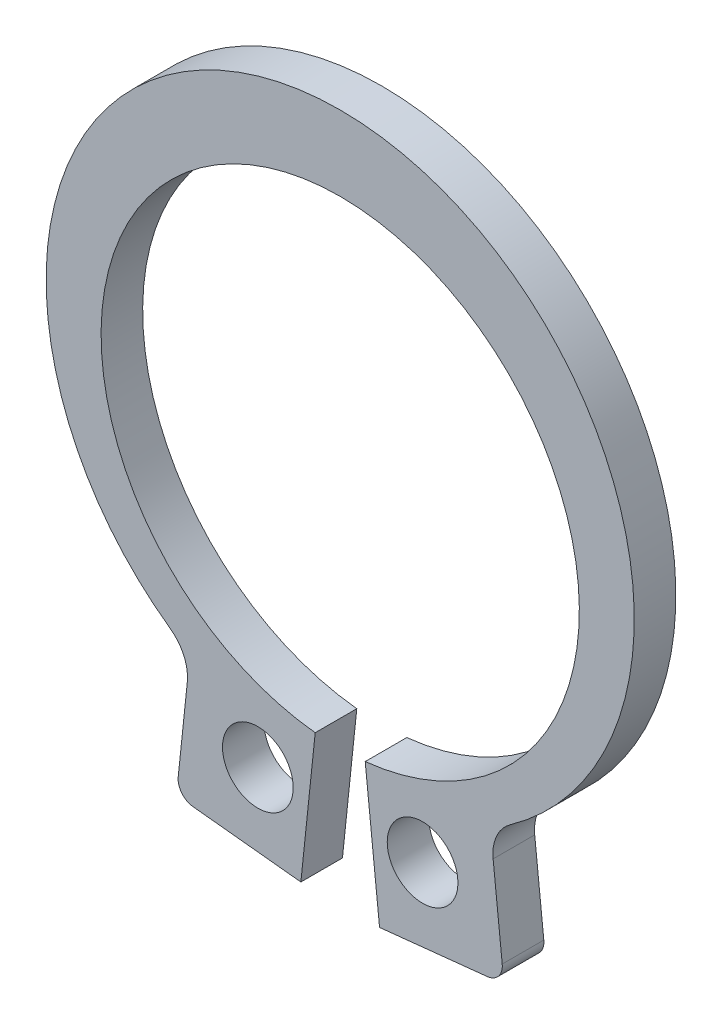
SolidWorks part; units mm, degrees
ref_plane "Face" through (0, 0, 0) normal (0, 0, 1) x (1, 0, 0)
ref_plane "Dessus" through (0, 0, 0) normal (0, 1, 0) x (1, 0, 0)
ref_plane "Droite" through (0, 0, 0) normal (1, 0, 0) x (0, 0, -1)
sketch "Esquisse1" plane through (0, 0, 0) normal (0, 0, 1) x (1, 0, 0)
  line L0 (-0.601, -5.7185) -> (-0.946, -9.0004)
  line L1 (-0.946, -9.0004) -> (-3.5397, -8.7278)
  line L2 (-3.8957, -8.2882) -> (-3.6769, -6.2071)
  line L3 (3.6769, -6.2071) -> (3.8957, -8.2882)
  line L4 (3.5397, -8.7278) -> (0.946, -9.0004)
  line L5 (0.946, -9.0004) -> (0.601, -5.7185)
  arc A0 (0.601, -5.7185) -> (-0.601, -5.7185) centre (0, 0) ccw
  arc A1 (-3.5397, -8.7278) -> (-3.8957, -8.2882) centre (-3.4978, -8.33) cw
  arc A2 (-3.6769, -6.2071) -> (-4.0926, -5.2871) centre (-4.6714, -6.1025) ccw
  arc A3 (-4.0926, -5.2871) -> (4.0926, -5.2871) centre (0, 0.4791) cw
  arc A4 (4.0926, -5.2871) -> (3.6769, -6.2071) centre (4.6714, -6.1025) ccw
  arc A5 (3.8957, -8.2882) -> (3.5397, -8.7278) centre (3.4978, -8.33) cw
  dimension "D1" = 5.75
  dimension "D2" = 7.0709
  dimension "D4" = 1
  dimension "D5" = 1
  dimension "D3" = 0.4791
  dimension "D6" = 9.3429
  dimension "D7" = 6.9957
extrude "Base-Extrusion" add sketch "Esquisse1" along normal blind 1
sketch "Esquisse2" plane through (0, 0, 0) normal (0, 0, 1) x (1, 0, 0)
  arc A0 (2.8304, -7.1301) -> (1.1304, -7.1301) centre (1.9804, -7.1301) cw
  arc A1 (1.1304, -7.1301) -> (2.8304, -7.1301) centre (1.9804, -7.1301) cw
extrude "Enlèv. mat.-Extru.1" cut sketch "Esquisse2" along normal blind 1
sketch "Esquisse3" plane through (0, 0, 0) normal (0, 0, 1) x (1, 0, 0)
  arc A0 (-2.8304, -7.1301) -> (-1.1304, -7.1301) centre (-1.9804, -7.1301) cw
  arc A1 (-1.1304, -7.1301) -> (-2.8304, -7.1301) centre (-1.9804, -7.1301) cw
extrude "Enlèv. mat.-Extru.2" cut sketch "Esquisse3" along normal blind 1
